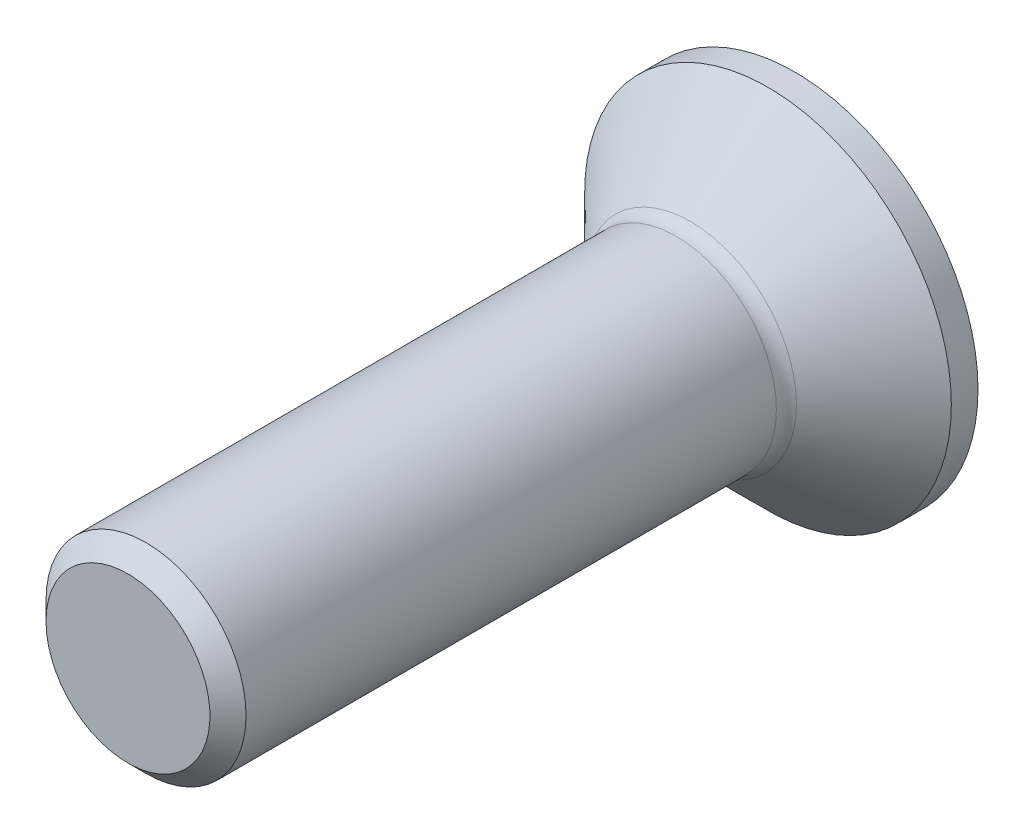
SolidWorks part; units mm, degrees
ref_plane "Plan1" through (0, 0, 0) normal (0, 0, 1) x (1, 0, 0)
ref_plane "Plan2" through (0, 0, 0) normal (0, 1, 0) x (1, 0, 0)
ref_plane "Plan3" through (0, 0, 0) normal (1, 0, 0) x (0, 0, -1)
sketch "Sketch1" plane through (0, 0, 0) normal (1, 0, 0) x (0, 0, -1)
  line L0 (0, 1.5) -> (1.65, 3.15)
  line L1 (1.65, 3.15) -> (1.65, 0)
  line L2 (0, 1.5) -> (-8.35, 1.5)
  line L3 (-8.35, 1.5) -> (-8.35, 0)
  line L4 (-8.35, 0) -> (1.65, 0) construction
  line L5 (-8.35, 0) -> (1.65, 0)
  line L6 (1.65, 0) -> (1.15, 0) construction
  dimension "D2" = 45
  dimension "K" = 1.65
  dimension "L" = 10
  dimension "D" = 3
  dimension "P" = 0.5
revolve "Base-Revolve" add sketch "Sketch1"
chamfer "Chamfer1" distance 0.2706 angle 45 1 edges at (1.5, 0, 8.35)
fillet "Fillet1" radius 0.3 1 edges at (1.5, 0, 0)
sketch "Sketch2" plane through (0, 0, -1.65) normal (0, 0, -1) x (-1, 0, 0)
  circle A0 centre (0, 0) radius 2.75
  circle A1 centre (0, 0) radius 3.15 construction
  dimension "DK" = 5.5
extrude "Cut-Extrude1" cut sketch "Sketch2" against normal through all flip side to cut
hole_wizard "Hole1" positions "Sketch4" profile "Sketch3" legacy
sketch "Sketch4" plane through (0, 0, -1.65) normal (0, 0, -1) x (-1, 0, 0)
  circle A0 centre (0, 0) radius 2.75 construction
  point P0 (0, 0)
sketch "Sketch3" plane through (0, 0, -1.65) normal (1, 0, 0) x (0, 1, 0)
  line L0 (0, 0) -> (0, 1.6274)
  line L1 (0, 1.6274) -> (1, 1.05)
  line L2 (1, 1.05) -> (1, 0)
  line L4 (1, 0) -> (0, 0)
  line L6 (0, 1.6274) -> (-1, 1.05) construction
  line L7 (0, -4.2442) -> (0, 117.3081) construction
  dimension "Diameter" = 2
  dimension "Depth" = 1.05
  dimension "Drill Angle" = 120
sketch "Sketch5" plane through (0, 0, -1.65) normal (0, 0, -1) x (-1, 0, 0)
  line L0 (-1.1547, 0) -> (1.1547, 0) construction
  line L1 (0, 1) -> (0, -1) construction
  line L2 (-0.5774, 1) -> (0.5774, 1)
  line L3 (0.5774, 1) -> (1.1547, 0)
  line L4 (1.1547, 0) -> (0.5774, -1)
  line L5 (0.5774, -1) -> (-0.5774, -1)
  line L6 (-0.5774, -1) -> (-1.1547, 0)
  line L7 (-1.1547, 0) -> (-0.5774, 1)
  circle A0 centre (0, 0) radius 1 construction
  dimension "D1" = 120
extrude "Cut-Extrude2" cut sketch "Sketch5" against normal blind 1.05
equation "\"D2@Cut-Extrude2\" = \"Depth@Sketch3\""
equation "\"D1@Cosmetic_Thread1\" = \"D@Sketch1\"-(1.0825*\"P@Sketch1\")"
equation "\"D1@Chamfer1\" = (\"D@Sketch1\"-\"D1@Cosmetic_Thread1\")/2"
